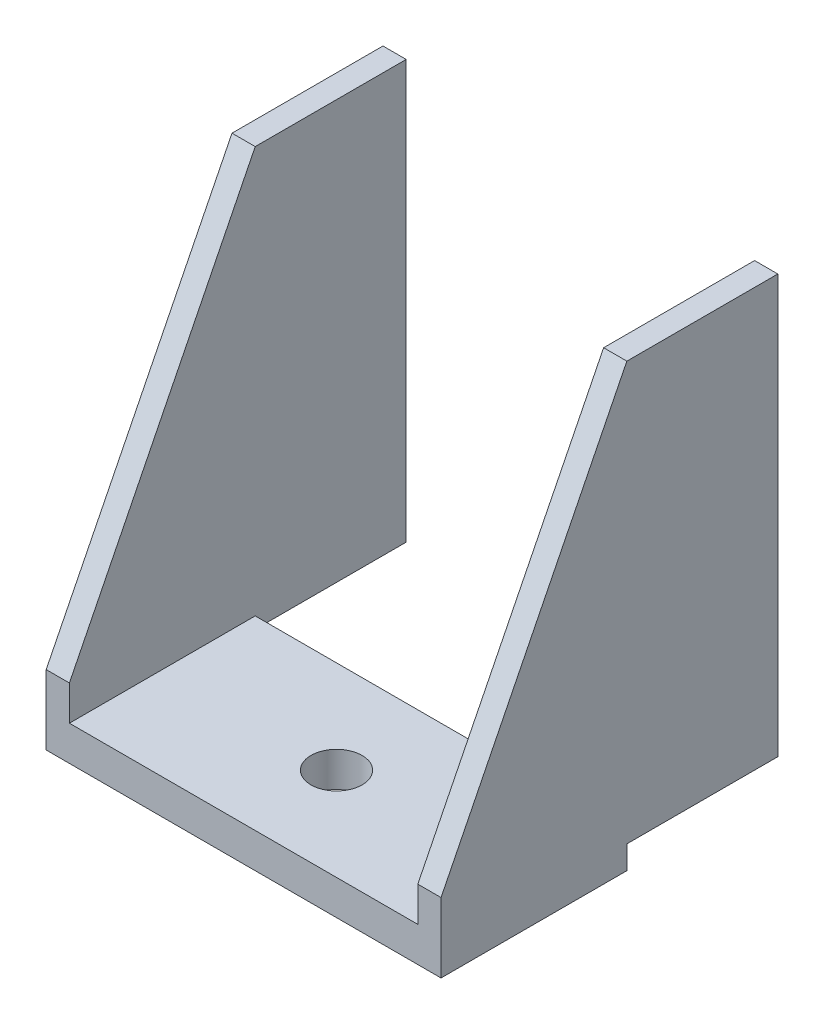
SolidWorks part; units mm, degrees
ref_plane "Front Plane" through (0, 0, 0) normal (0, 0, 1) x (1, 0, 0)
ref_plane "Top Plane" through (0, 0, 0) normal (0, 1, 0) x (1, 0, 0)
ref_plane "Right Plane" through (0, 0, 0) normal (1, 0, 0) x (0, 0, -1)
sketch "Sketch2" plane through (0, 0, 0) normal (0, 1, 0) x (1, 0, 0)
  line L1 (-75, -40) -> (75, -40)
  line L2 (-75, -40) -> (-75, 40)
  line L3 (-75, 40) -> (75, 40)
  line L4 (75, -40) -> (75, 40)
  line L5 (-75, -40) -> (75, 40) construction
  line L6 (-75, 40) -> (75, -40) construction
  circle A0 centre (0, 0) radius 11
  point P0 (0, 0)
  dimension "D3" = 22
  dimension "D1" = 80
  dimension "D2" = 150
extrude "Boss-Extrude1" add sketch "Sketch2" along normal blind 15
sketch "Sketch3" plane through (75, 0, 0) normal (1, 0, 0) x (0, 0, -1)
  line L0 (40, 0) -> (40, 10)
  line L1 (40, 10) -> (105, 10)
  line L2 (105, 10) -> (105, 190)
  line L3 (105, 190) -> (40, 190)
  line L4 (40, 190) -> (-40, 30)
  line L5 (-40, 30) -> (-40, 0)
  line L6 (-40, 0) -> (40, 0)
  line L7 (-40, 15) -> (-40, 0) construction
  dimension "D1" = 180
  dimension "D2" = 65
  dimension "D3" = 30
  dimension "D4" = 10
extrude "Boss-Extrude2" add sketch "Sketch3" along normal blind 10
mirror "Mirror1" about plane through (0, 0, 0) normal (1, 0, 0) of "Boss-Extrude2"
